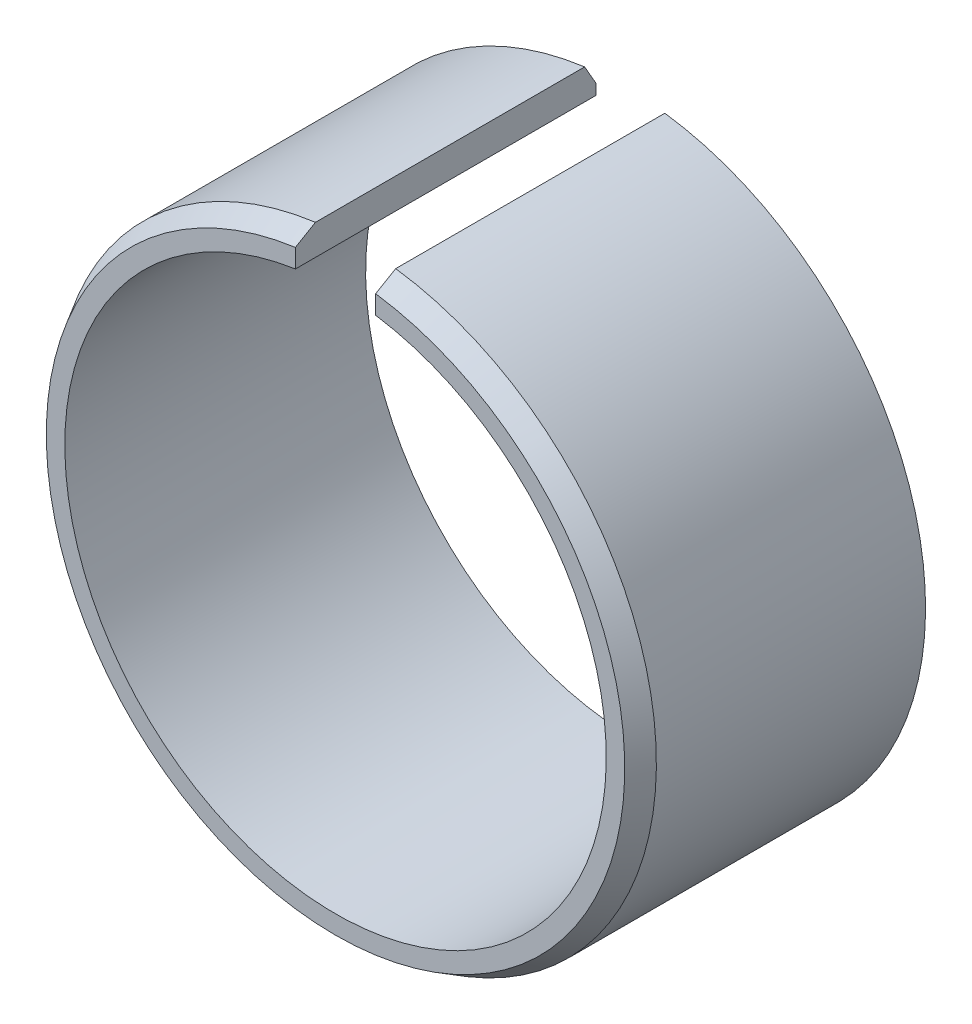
SolidWorks part; units mm, degrees
ref_plane "Plan de face" through (0, 0, 0) normal (0, 0, 1) x (1, 0, 0)
ref_plane "Plan de dessus" through (0, 0, 0) normal (0, 1, 0) x (1, 0, 0)
ref_plane "Plan de droite" through (0, 0, 0) normal (1, 0, 0) x (0, 0, -1)
sketch "Esquisse1" plane through (0, 0, 0) normal (0, 0, 1) x (1, 0, 0)
  line L0 (0, 0) -> (0, 18.3231) construction
  line L1 (-2, 14.8661) -> (-2, 13.351)
  line L2 (2, 14.8661) -> (2, 13.351)
  arc A0 (-2, 13.351) -> (2, 13.351) centre (0, 0) ccw
  arc A1 (-2, 14.8661) -> (2, 14.8661) centre (0, 0) ccw
  dimension "D1" = 27
  dimension "D2" = 30
  dimension "D3" = 4
extrude "Extrusion1" add sketch "Esquisse1" along normal blind 15
chamfer "Chanfrein1" distance 1 angle 30 2 edges at (0, -15, 15) (0, -15, 0)
